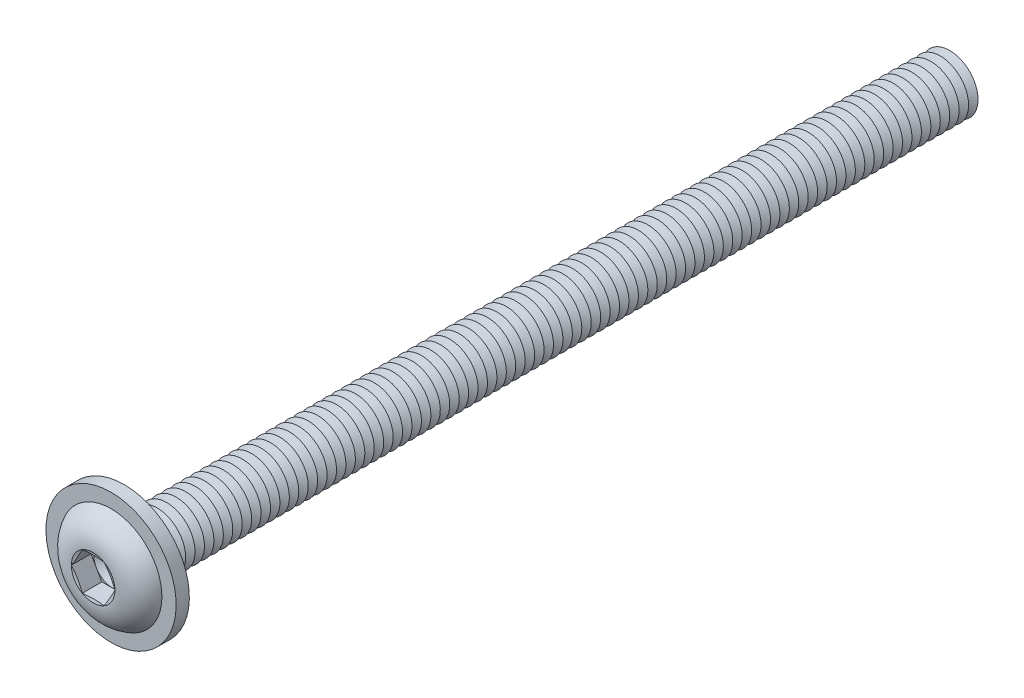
SolidWorks part; units mm, degrees
ref_plane "Front Plane" through (0, 0, 0) normal (0, 0, 1) x (1, 0, 0)
ref_plane "Top Plane" through (0, 0, 0) normal (0, 1, 0) x (1, 0, 0)
ref_plane "Right Plane" through (0, 0, 0) normal (1, 0, 0) x (0, 0, -1)
sketch "Sketch1" plane through (0, 0, 0) normal (1, 0, 0) x (0, 0, -1)
  line L0 (0, 1.5) -> (0, 2.85)
  line L3 (0, 1.5) -> (44, 1.5)
  line L4 (44, 1.5) -> (44, 0)
  line L5 (44, 0) -> (-1.65, 0) construction
  line L6 (-1.65, 0) -> (44, 0)
  line L7 (-1.65, 1.1547) -> (-1.65, 0.5773) construction
  line L8 (-1.65, 0.5773) -> (-1.65, 0)
  line L9 (-1.65, 1.1547) -> (-1.4953, 0.5773)
  line L10 (-1.4953, 0.5773) -> (-1.65, 0.5773)
  line L11 (44, 0) -> (22.7481, 0) construction
  line L12 (0, 2.85) -> (-1.65, 2.85) construction
  arc A1 (0, 2.85) -> (-1.65, 1.1547) centre (0, 1.1994) ccw
  point P8 (44, 0.75)
  dimension "D1" = 5.7
  dimension "D2" = 3
  dimension "D3" = 1.65
  dimension "D4" = 2.3094
  dimension "D5" = 44
  dimension "D6" = 15
revolve "Revolve1" add sketch "Sketch1" angle 360 about L5
fillet "Fillet1" radius 0.25 1 edges at (0, 1.5, 0)
sketch "Sketch2" plane through (0, 0, 0) normal (1, 0, 0) x (0, 0, -1)
  line L0 (43.75, 1.5) -> (44.25, 1.5)
  line L1 (44, 1.5) -> (0.25, 1.5) construction
  line L2 (44.25, 1.5) -> (44, 1.067)
  line L3 (44, -1.5) -> (44, 1.5) construction
  line L4 (44, 1.067) -> (43.75, 1.5)
  dimension "D1" = 0.5
revolve "Cut-Revolve1" cut sketch "Sketch2" angle 360 about axis through (0, 0, -44) along (0, 0, -1)
pattern_linear "LPattern1" count 88 spacing 0.5 along (0, 0, 1) of "Cut-Revolve1"
sketch "Sketch3" plane through (0, 0, 1.65) normal (0, 0, 1) x (1, 0, 0)
  line L7 (0.5773, 1) -> (-0.5774, 1)
  line L8 (-0.5774, 1) -> (-1.1547, 0)
  line L9 (-1.1547, 0) -> (-0.5773, -1)
  line L10 (-0.5773, -1) -> (0.5773, -1)
  line L11 (0.5773, -1) -> (1.1547, 0)
  line L12 (1.1547, 0) -> (0.5773, 1)
  circle A0 centre (0, 0) radius 1 construction
  circle A3 centre (0, 0) radius 1.1547 construction
extrude "Cut-Extrude1" cut sketch "Sketch3" against normal blind 1.04
sketch "Sketch4" plane through (0, 0, 0.61) normal (0, 0, 1) x (1, 0, 0)
  line L1 (0.5773, 1) -> (-0.5774, 1) construction
  circle A0 centre (0, 0) radius 1
extrude "Cut-Extrude2" cut sketch "Sketch4" against normal through all draft 60
sketch "Sketch5" plane through (0, 0, 0) normal (0, 0, -1) x (-1, 0, 0)
  circle A0 centre (0, 0) radius 3.45
  circle A1 centre (0, 0) radius 1.75
  circle A2 centre (0, 0) radius 1.75 construction
  dimension "D1" = 6.9
extrude "Boss-Extrude1" add sketch "Sketch5" against normal blind 0.7
